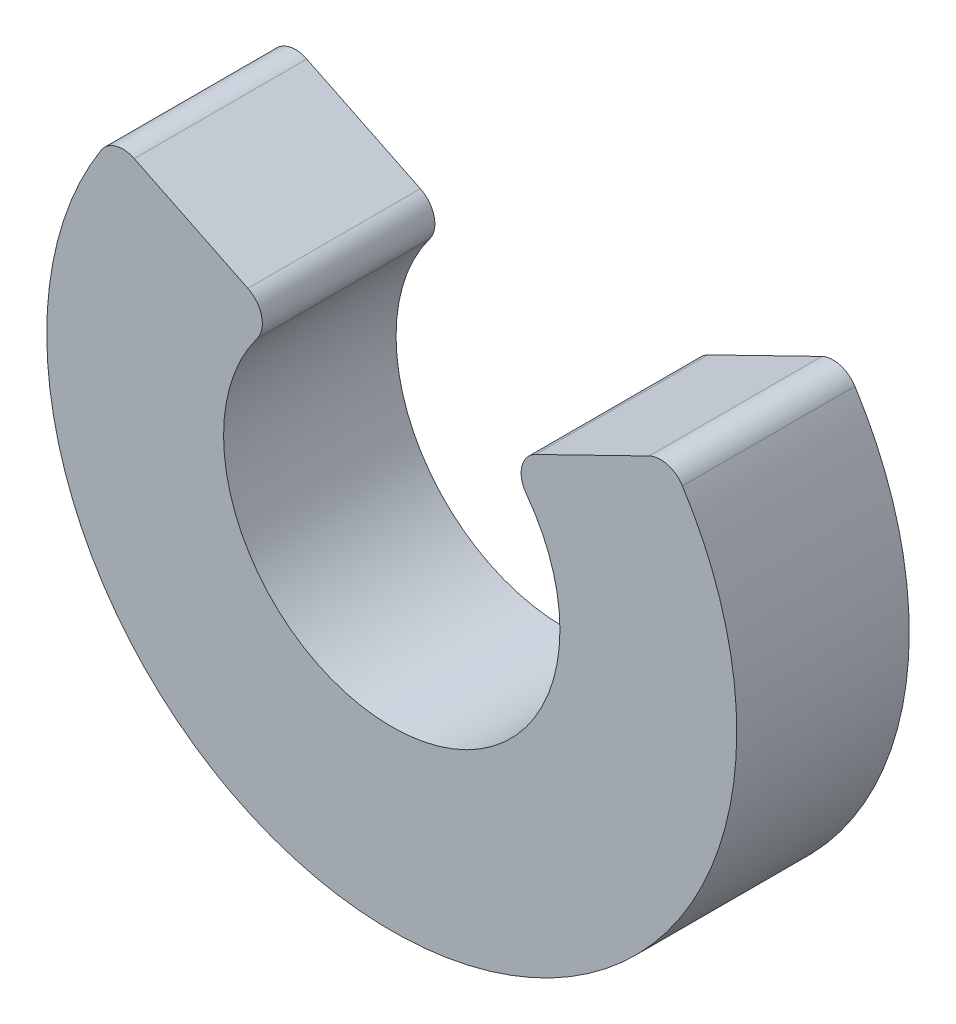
SolidWorks part; units mm, degrees
ref_plane "Plan de face" through (0, 0, 0) normal (0, 0, 1) x (1, 0, 0)
ref_plane "Plan de dessus" through (0, 0, 0) normal (0, 1, 0) x (1, 0, 0)
ref_plane "Plan de droite" through (0, 0, 0) normal (1, 0, 0) x (0, 0, -1)
sketch "Esquisse1" plane through (0, 0, 0) normal (0, 0, 1) x (1, 0, 0)
  line L0 (-2.9857, 2.2627) -> (-1.6684, 1.6196)
  line L1 (0, 0) -> (0, 3.6342) construction
  line L2 (2.9857, 2.2627) -> (1.6684, 1.6196)
  line L3 (-1.5, 2.2497) -> (-1.5, 0.2927) construction
  line L4 (1.5, 2.2497) -> (1.5, 0.2927) construction
  arc A0 (-1.56, 1.17) -> (1.56, 1.17) centre (0, 0) ccw
  arc A1 (-3.37, 2.1547) -> (3.37, 2.1547) centre (0, 0) ccw
  arc A2 (2.9857, 2.2627) -> (3.37, 2.1547) centre (3.1173, 1.9931) cw
  arc A3 (1.6684, 1.6196) -> (1.56, 1.17) centre (1.8, 1.35) ccw
  arc A4 (-2.9857, 2.2627) -> (-3.37, 2.1547) centre (-3.1173, 1.9931) ccw
  arc A5 (-1.6684, 1.6196) -> (-1.56, 1.17) centre (-1.8, 1.35) cw
  dimension "D1" = 3.9
  dimension "D2" = 8
  dimension "D3" = 0.3
  dimension "D4" = 3
extrude "Boss.-Extru.1" add sketch "Esquisse1" along normal blind 2
